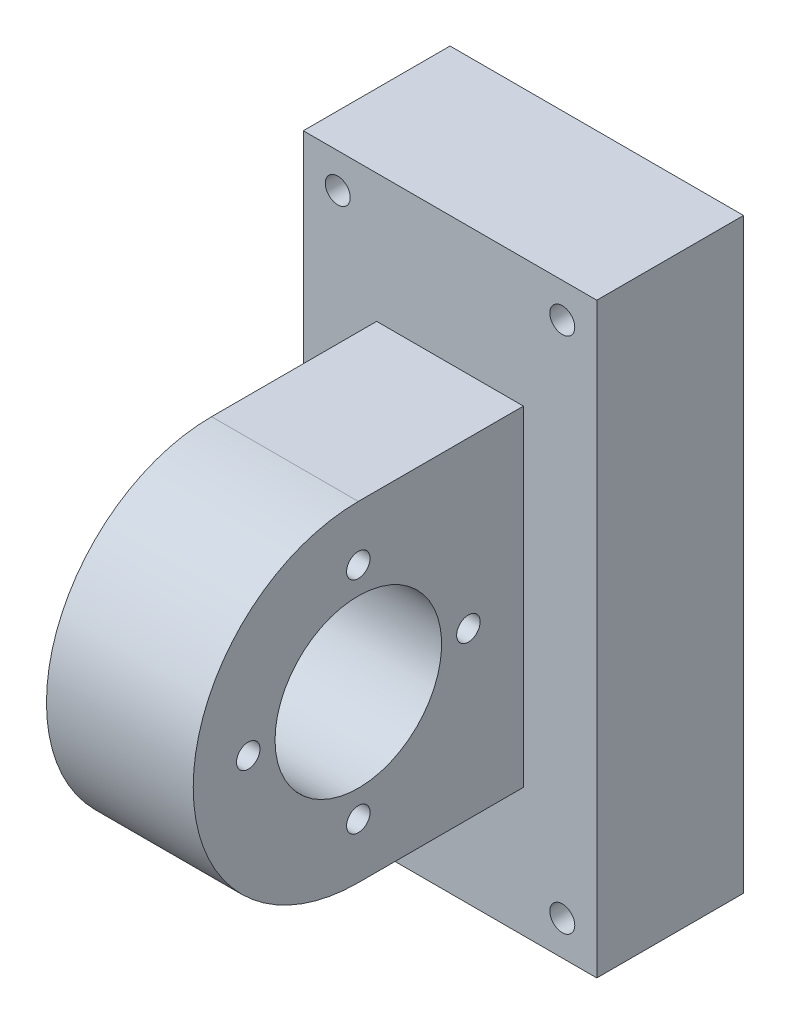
SolidWorks part; units mm, degrees
ref_plane "Piano frontale" through (0, 0, 0) normal (0, 0, 1) x (1, 0, 0)
ref_plane "Piano superiore" through (0, 0, 0) normal (0, 1, 0) x (1, 0, 0)
ref_plane "Piano destro" through (0, 0, 0) normal (1, 0, 0) x (0, 0, -1)
sketch "Sketch1" plane through (0, 0, 0) normal (0, 0, 1) x (1, 0, 0)
  line L1 (-10, -40) -> (10, -40)
  line L2 (-10, -40) -> (-10, 40)
  line L3 (-10, 40) -> (10, 40)
  line L4 (10, -40) -> (10, 40)
  line L5 (-10, -40) -> (10, 40) construction
  line L6 (-10, 40) -> (10, -40) construction
  point P0 (0, 0)
  dimension "D1" = 20
  dimension "D2" = 80
extrude "Boss-Extrude1" add sketch "Sketch1" along normal blind 20
sketch "Sketch8" plane through (-10, 0, 0) normal (-1, 0, 0) x (0, 0, 1)
  line L0 (42.5, 22.5) -> (20, 22.5)
  line L1 (42.5, -22.5) -> (20, -22.5)
  line L2 (20, 40) -> (20, -40) construction
  line L3 (26, 12.7) -> (20, 12.7)
  line L4 (26, -12.7) -> (20, -12.7)
  line L5 (20, -22.5) -> (20, 22.5)
  circle A0 centre (42.5, 0) radius 11.35
  circle A1 centre (42.5, 0) radius 22.5
  point P4 (20, 0)
  point P5 (26, 12.7)
  point P8 (20, 0)
  point P13 (20, 0)
  dimension "D1" = 45
  dimension "D3" = 0
  dimension "D4" = 25.4
  dimension "D5" = 0
  dimension "D2" = 22.7
ref_plane "Plane2" through (-10, 0, 0) normal (-1, 0, 0) x (0, 0, 1)
sketch "Sketch12" plane through (0, 0, 20) normal (0, 0, 1) x (1, 0, 0)
  line L1 (10, -40) -> (10, 40) construction
  line L2 (10, 40) -> (-10, 40) construction
  circle A0 centre (5.3, 35.3) radius 1.7
  point P2 (5.3, 37)
  point P4 (7, 35.3)
  dimension "D1" = 3.4
  dimension "D2" = 3
  dimension "D3" = 3
ref_plane "Plane3" through (0, 0, 0) normal (0, -1, 0) x (-1, 0, 0)
extrude "Cut-Extrude1" cut sketch "Sketch12" against normal through all contours A0
mirror "Mirror1" about plane through (0, 0, 0) normal (0, -1, 0) of "Cut-Extrude1"
mirror "Mirror3" about plane through (-10, 0, 0) normal (-1, 0, 0) of "Boss-Extrude1", "Mirror1", "Cut-Extrude1"
extrude "Boss-Extrude2" add sketch "Sketch8" along normal blind 10 and the other way blind 10
sketch "Sketch14" plane through (0, 0, 0) normal (1, 0, 0) x (0, 0, -1)
  circle A0 centre (-57.5, 0) radius 1.6
  dimension "D1" = 3.2
ref_point "Point1"
extrude "Cut-Extrude2" cut sketch "Sketch14" against normal blind 20 contours A0
pattern_circular "CirPattern2" count 4 over 360 about axis through (0, 0, 42.5) along (1, 0, 0) of "Cut-Extrude2"
